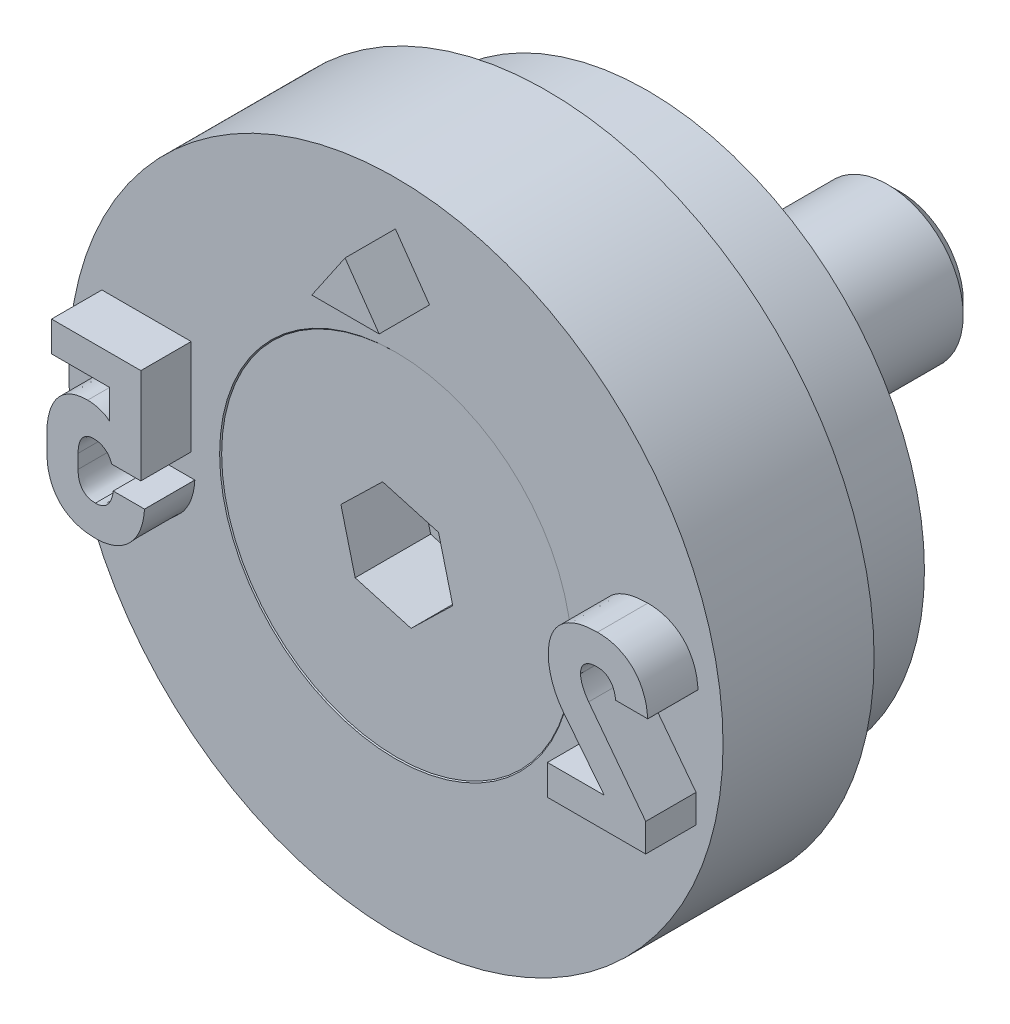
SolidWorks part; units mm, degrees
other "<M3 X .5 FHCS>-<Imported1>"
ref_plane "Front Plane" through (0, 0, 0) normal (0, 0, 1) x (1, 0, 0)
ref_plane "Top Plane" through (0, 0, 0) normal (0, 1, 0) x (1, 0, 0)
ref_plane "Right Plane" through (0, 0, 0) normal (1, 0, 0) x (0, 0, -1)
imported_body "Imported1"
other "DeleteFace1"
sketch "Sketch1" plane through (0, 0, 0) normal (0, 0, 1) x (1, 0, 0)
  line L0 (-0.0087, 5.6166) -> (-0.6694, 4.6482)
  line L1 (-0.6694, 4.6482) -> (0.6694, 4.6482)
  line L2 (0.6694, 4.6482) -> (-0.0087, 5.6166)
  text T0 "2      5" font "Bahnschrift" height 3.302
  dimension "D1" = 1.651
extrude "Boss-Extrude1" add sketch "Sketch1" along normal blind 1
inserted part "M3 X .5 FHCS"
move or copy body "Body-Move/Copy2" placed by mates yes
